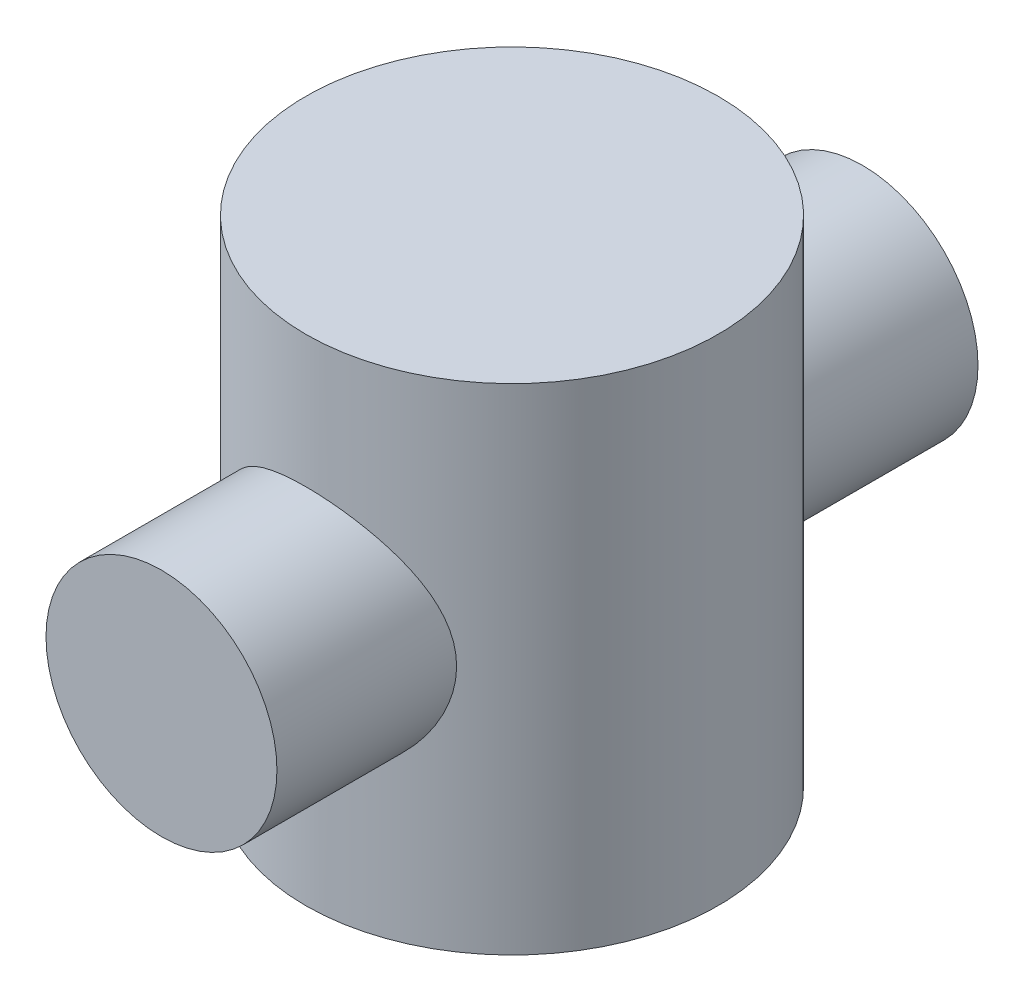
SolidWorks part; units mm, degrees
ref_plane "前视基准面" through (0, 0, 0) normal (0, 0, 1) x (1, 0, 0)
ref_plane "上视基准面" through (0, 0, 0) normal (0, 1, 0) x (1, 0, 0)
ref_plane "右视基准面" through (0, 0, 0) normal (1, 0, 0) x (0, 0, -1)
sketch "草图1" plane through (0, 0, 0) normal (0, 1, 0) x (1, 0, 0)
  circle A0 centre (0, 0) radius 50
  dimension "D1" = 100
extrude "凸台-拉伸1" add sketch "草图1" along normal blind 120
sketch "草图2" plane through (0, 0, 0) normal (0, 0, 1) x (1, 0, 0)
  line L0 (0, 120) -> (0, 0) construction
  line L1 (50, 120) -> (-50, 120) construction
  line L2 (-37.6041, 60) -> (38.3895, 60) construction
  circle A0 centre (0, 60) radius 28
  dimension "D1" = 56
extrude "凸台-拉伸2" add sketch "草图2" along normal mid plane 170
